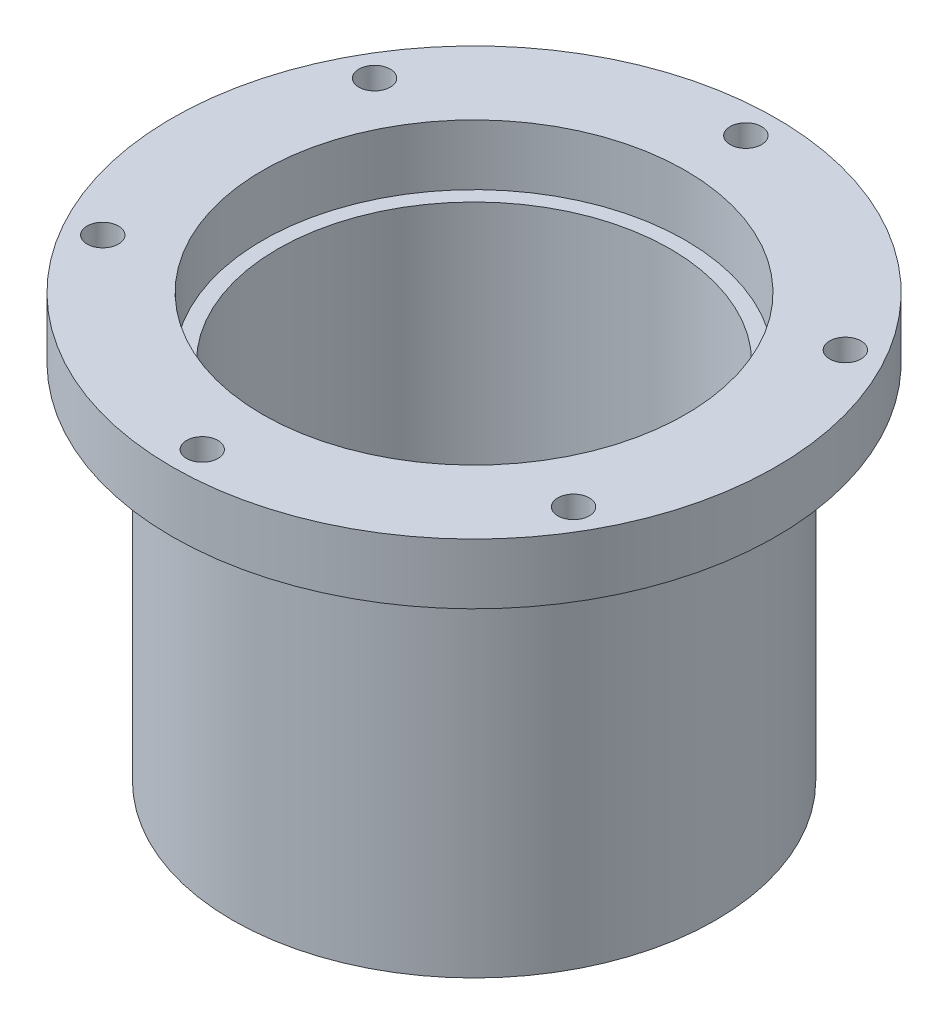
SolidWorks part; units mm, degrees
ref_plane "Front Plane" through (0, 0, 0) normal (0, 0, 1) x (1, 0, 0)
ref_plane "Top Plane" through (0, 0, 0) normal (0, 1, 0) x (1, 0, 0)
ref_plane "Right Plane" through (0, 0, 0) normal (1, 0, 0) x (0, 0, -1)
sketch "Sketch1" plane through (0, 0, 0) normal (0, 0, 1) x (1, 0, 0)
  line L0 (0, 77.3658) -> (0, -50.9341) construction
  line L1 (22.225, 0) -> (25.2222, 0)
  line L2 (25.2222, 0) -> (25.2222, -5.207)
  line L3 (25.2222, -5.207) -> (50.8, -5.207)
  line L4 (50.8, -5.207) -> (50.8, 70.993)
  line L5 (50.8, 70.993) -> (63.5, 70.993)
  line L6 (63.5, 70.993) -> (63.5, 83.693)
  line L7 (63.5, 83.693) -> (44.45, 83.693)
  line L8 (44.45, 83.693) -> (44.45, 70.993)
  line L9 (44.45, 70.993) -> (41.275, 70.993)
  line L10 (41.275, 70.993) -> (41.275, 4.7498)
  line L11 (41.275, 4.7498) -> (22.225, 4.7498)
  line L12 (22.225, 4.7498) -> (22.225, 0)
  dimension "D1" = 50.8
  dimension "D2" = 63.5
  dimension "D3" = 25.2222
  dimension "D4" = 5.207
  dimension "D5" = 44.45
  dimension "D6" = 4.7498
  dimension "D7" = 22.225
  dimension "D8" = 12.7
  dimension "D9" = 12.7
  dimension "D10" = 88.9
  dimension "D11" = 41.275
revolve "Revolve1" add sketch "Sketch1" angle 360 about L0
sketch "Sketch2" plane through (0, -5.207, 0) normal (0, -1, 0) x (1, 0, 0)
  circle A0 centre (0, 32.766) radius 3.1178
  dimension "D1" = 6.2356
  dimension "D2" = 32.766
extrude "Cut-Extrude1" cut sketch "Sketch2" against normal through all
pattern_circular "CirPattern1" count 4 over 360 about axis through (0, 0, 0) along (0, 1, 0) of "Cut-Extrude1"
sketch "Sketch3" plane through (0, 83.693, 0) normal (0, 1, 0) x (-1, 0, 0)
  circle A0 centre (0, -57.15) radius 3.302
  dimension "D1" = 6.604
  dimension "D2" = 57.15
extrude "Cut-Extrude2" cut sketch "Sketch3" against normal through all
pattern_circular "CirPattern2" count 6 over 360 about axis through (0, 0, 0) along (0, 1, 0) of "Cut-Extrude2"
